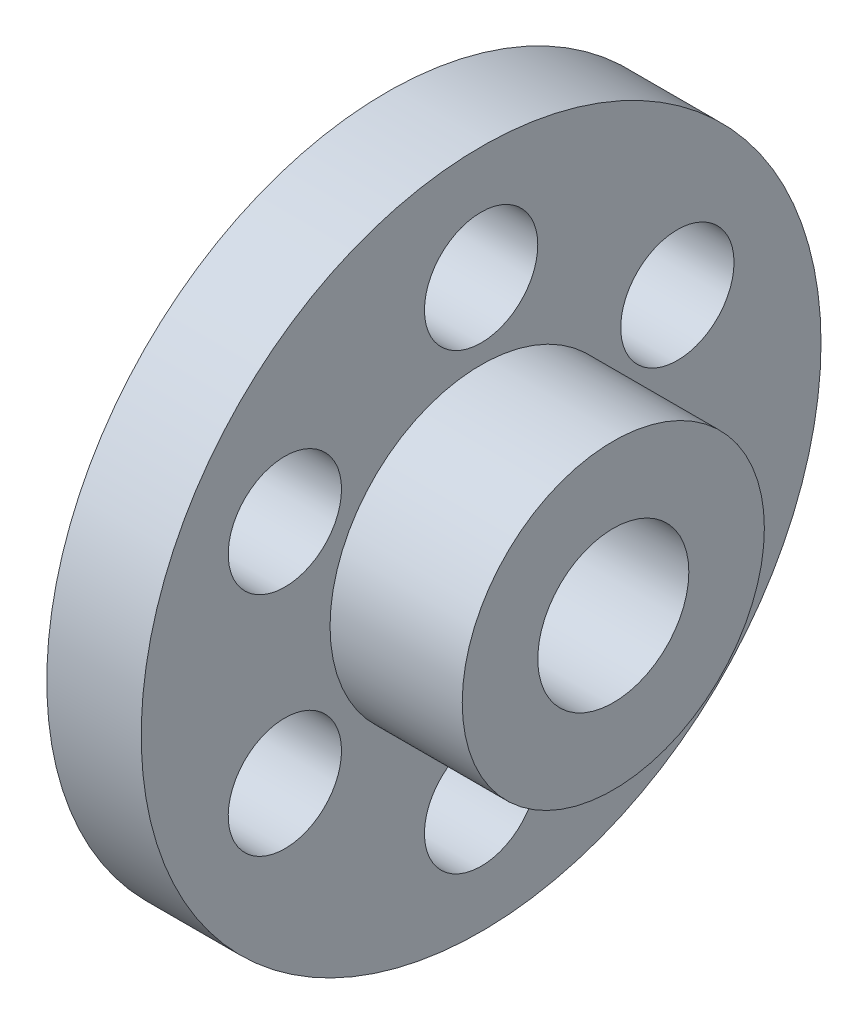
SolidWorks part; units mm, degrees
ref_plane "Płaszczyzna przednia" through (0, 0, 0) normal (0, 0, 1) x (1, 0, 0)
ref_plane "Płaszczyzna górna" through (0, 0, 0) normal (0, 1, 0) x (1, 0, 0)
ref_plane "Płaszczyzna prawa" through (0, 0, 0) normal (1, 0, 0) x (0, 0, -1)
sketch "Szkic bazowy" plane through (0, 0, 0) normal (0, 0, 1) x (1, 0, 0)
  line L0 (0, 0) -> (-52.1059, 0) construction
  line L1 (0, 0) -> (0, 90)
  line L2 (0, 90) -> (25, 90)
  line L3 (25, 90) -> (25, 40)
  line L4 (25, 40) -> (60, 40)
  line L5 (60, 40) -> (60, 0)
  line L6 (60, 0) -> (0, 0)
  dimension "D1" = 180
  dimension "D2" = 80
  dimension "D3" = 25
  dimension "Długość" = 60
revolve "Obrót bazowy" add sketch "Szkic bazowy" angle 360 about L0
sketch "Szkic otworu środkowego" plane through (60, 0, 0) normal (1, 0, 0) x (0, 0, -1)
  circle A0 centre (0, 0) radius 20
  dimension "D1" = 40
extrude "Otwór środkowy" cut sketch "Szkic otworu środkowego" against normal through all
sketch "Szkic otworu mocowania" plane through (0, 0, 0) normal (-1, 0, 0) x (0, 0, 1)
  circle A6 centre (0, 0) radius 60 construction
  circle A7 centre (0, 60) radius 15
  dimension "Średnica osadzenia" = 120
  dimension "Średnica otworu" = 30
extrude "Otwór mocowania" cut sketch "Szkic otworu mocowania" against normal through all
pattern_circular "Powielenie otworów" count 6 over 360 about axis through (0, 0, 0) along (1, 0, 0) of "Otwór mocowania"
